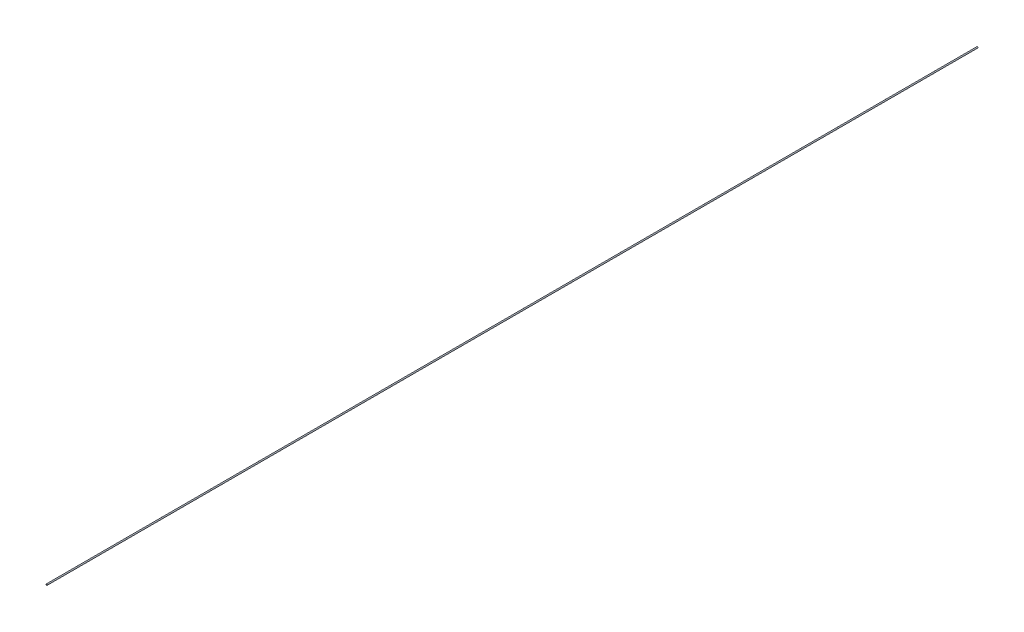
SolidWorks part; units mm, degrees
ref_plane "Plan de face" through (0, 0, 0) normal (0, 0, 1) x (1, 0, 0)
ref_plane "Plan de dessus" through (0, 0, 0) normal (0, 1, 0) x (1, 0, 0)
ref_plane "Plan de droite" through (0, 0, 0) normal (1, 0, 0) x (0, 0, -1)
sketch "Esquisse1" plane through (0, 0, -4090) normal (0, 0, 1) x (1, 0, 0)
  circle A0 centre (0, 0) radius 1.5
  dimension "D1" = 3
extrude "Extrusion1" add sketch "Esquisse1" along normal up to surface (2360 mm away)
